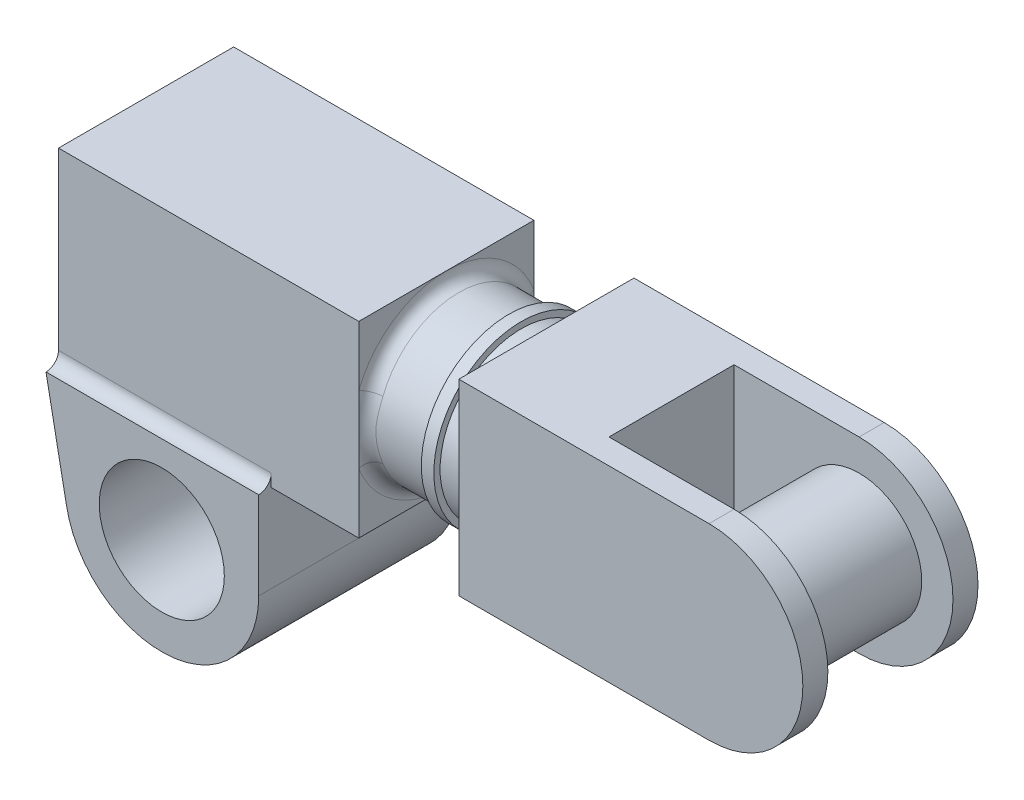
SolidWorks part; units mm, degrees
ref_plane "Front Plane" through (0, 0, 0) normal (0, 0, 1) x (1, 0, 0)
ref_plane "Top Plane" through (0, 0, 0) normal (0, 1, 0) x (1, 0, 0)
ref_plane "Right Plane" through (0, 0, 0) normal (1, 0, 0) x (0, 0, -1)
sketch "Sketch1" plane through (0, 0, 0) normal (1, 0, 0) x (0, 0, -1)
  line L1 (-70, 75) -> (70, 75)
  line L2 (-70, 75) -> (-70, -75)
  line L3 (-70, -75) -> (70, -75)
  line L4 (70, 75) -> (70, -75)
  line L5 (-70, 75) -> (70, -75) construction
  line L6 (-70, -75) -> (70, 75) construction
  point P0 (0, 0)
  dimension "D1" = 150
  dimension "D2" = 140
extrude "Boss-Extrude1" add sketch "Sketch1" along normal blind 240
sketch "Sketch2" plane through (240, 0, 0) normal (1, 0, 0) x (0, 0, -1)
  circle A0 centre (0, 0) radius 65
  dimension "D1" = 130
extrude "Boss-Extrude2" add sketch "Sketch2" along normal blind 50
sketch "Sketch3" plane through (290, 0, 0) normal (1, 0, 0) x (0, 0, -1)
  circle A0 centre (0, 0) radius 70
  dimension "D1" = 140
extrude "Boss-Extrude3" add sketch "Sketch3" along normal blind 10
sketch "Sketch4" plane through (0, 0, 0) normal (0, 0, 1) x (1, 0, 0)
  line L0 (0, -75) -> (16.2188, -158.4383)
  line L1 (0, 75) -> (0, -75) construction
  line L2 (170.0448, -145) -> (170.0448, -75)
  line L3 (240, -75) -> (0, -75) construction
  line L4 (0, -75) -> (170.0448, -75)
  arc A0 (16.2188, -158.4383) -> (170.0448, -145) centre (92.5448, -145) ccw
  circle A1 centre (92.5448, -145) radius 50
  dimension "D1" = 100
  dimension "D2" = 155
  dimension "D3" = 191
  dimension "D4" = 85
  dimension "D5" = 70
extrude "Boss-Extrude4" add sketch "Sketch4" along normal mid plane 160
fillet "Fillet1" radius 10 3 edges at (240, 0, -65) (85.0224, -75, 70) (85.0224, -75, -70)
sketch "Sketch5" plane through (300, 0, 0) normal (1, 0, 0) x (0, 0, -1)
  circle A0 centre (0, 0) radius 65
  dimension "D1" = 130
extrude "Boss-Extrude5" add sketch "Sketch5" along normal blind 20
sketch "Sketch6" plane through (0, 0, 0) normal (0, 0, 1) x (1, 0, 0)
  line L0 (520, 75) -> (320, 75)
  line L1 (320, 75) -> (320, -75)
  line L2 (320, -75) -> (520, -75)
  line L3 (320, -65) -> (320, 65) construction
  arc A0 (520, -75) -> (520, 75) centre (520, 0) ccw
  dimension "D1" = 150
  dimension "D2" = 200
extrude "Boss-Extrude6" add sketch "Sketch6" along normal mid plane 140
sketch "Sketch7" plane through (0, 0, 0) normal (0, 0, 1) x (1, 0, 0)
  line L0 (520, 75) -> (420, 75)
  line L1 (520, 75) -> (320, 75) construction
  line L2 (420, 75) -> (420, -75)
  line L3 (320, -75) -> (520, -75) construction
  line L4 (420, -75) -> (520, -75)
  arc A0 (520, -75) -> (520, 75) centre (520, 0) ccw construction
  arc A1 (520, -75) -> (520, 75) centre (520, 0) ccw
  dimension "D1" = 100
extrude "Cut-Extrude1" cut sketch "Sketch7" against normal mid plane 100
sketch "Sketch8" plane through (0, 0, -50) normal (0, 0, 1) x (1, 0, 0)
  circle A0 centre (520, 0) radius 50
  dimension "D1" = 100
extrude "Boss-Extrude7" add sketch "Sketch8" along normal up to next
